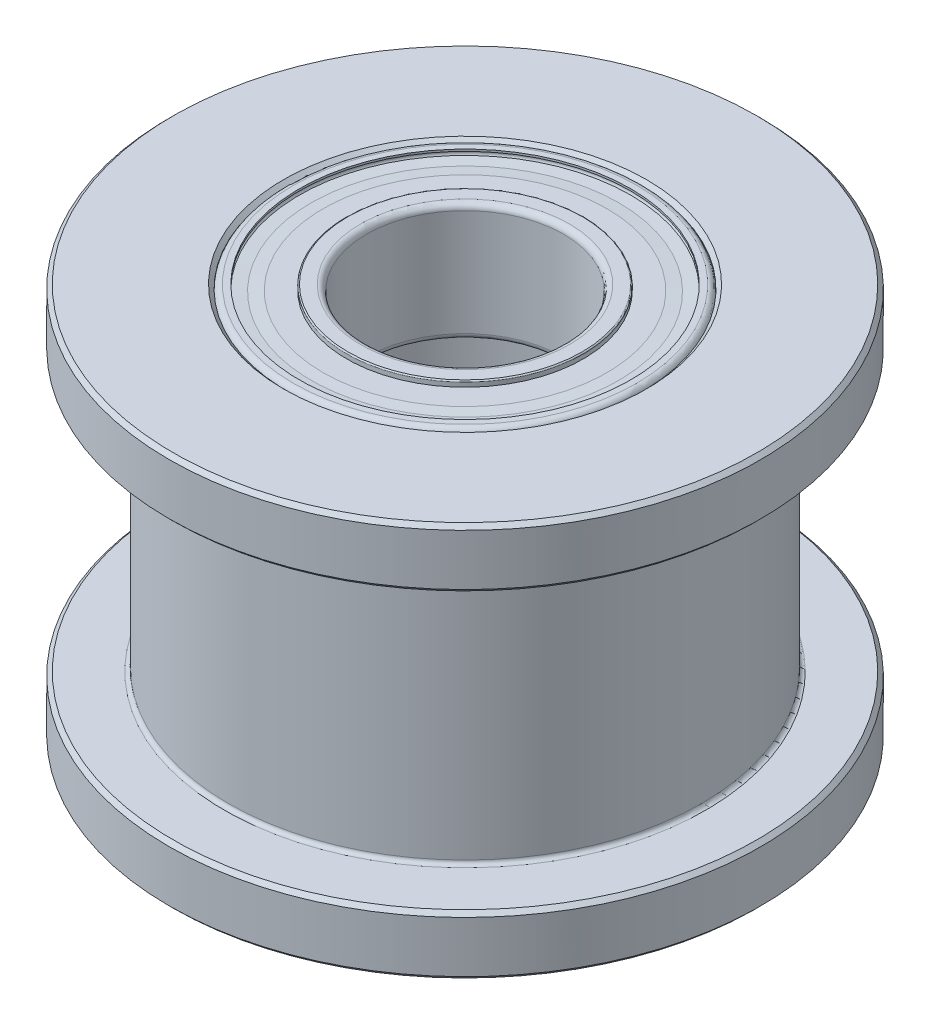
SolidWorks part; units mm, degrees
ref_plane "Přední rovina" through (0, 0, 0) normal (0, 0, 1) x (1, 0, 0)
ref_plane "Horní rovina" through (0, 0, 0) normal (0, 1, 0) x (1, 0, 0)
ref_plane "Pravá rovina" through (0, 0, 0) normal (1, 0, 0) x (0, 0, -1)
sketch "Skica1" plane through (0, 0, 0) normal (0, 0, 1) x (1, 0, 0)
  line L0 (4.5, 10) -> (7.5, 10)
  line L1 (7.5, 10) -> (7.5, 8.5)
  line L2 (7.5, 8.5) -> (6, 8.5)
  line L3 (6, 8.5) -> (6, 1.5)
  line L4 (6, 1.5) -> (7.5, 1.5)
  line L5 (7.5, 1.5) -> (7.5, 0)
  line L6 (7.5, 0) -> (4.5, 0)
  line L8 (4.5, 10) -> (4.5, 7)
  line L9 (4.5, 7) -> (3.5, 7)
  line L10 (3.5, 7) -> (3.5, 3)
  line L11 (3.5, 3) -> (4.5, 3)
  line L12 (4.5, 3) -> (4.5, 0)
  line L13 (0, 0) -> (0, -4.1646) construction
  dimension "D1" = 1.5
  dimension "D2" = 7
  dimension "D3" = 4.5
  dimension "D4" = 3.5
  dimension "D5" = 6
  dimension "D6" = 3
  dimension "D7" = 7.5
revolve "Rotovat1" add sketch "Skica1" angle 360 about L13
chamfer "Zkosení1" distance 0.1 angle 45 8 edges at (0, 3, 3.5) (0, 0, 4.5) (0, 7, 3.5) (0, 0, 7.5) (0, 1.5, 7.5) (0, 8.5, 7.5) (0, 10, 7.5) (0, 10, 4.5)
fillet "Zaoblit1" radius 0.1 4 edges at (0, 3, 4.5) (0, 1.5, 6) (0, 8.5, 6) (0, 7, 4.5)
sketch "Skica4" plane through (0, 0, 0) normal (0, 0, 1) x (1, 0, 0)
  line L0 (4.5, 9.85) -> (4.5, 7.15)
  line L1 (4.35, 7) -> (4.2, 7)
  line L2 (4.2, 7) -> (4.2, 7.05)
  line L3 (3.85, 7.2828) -> (4.2132, 7.229)
  line L4 (3.85, 7.2828) -> (3.85, 8.0528)
  line L5 (3.85, 8.9472) -> (3.85, 9.7172)
  line L6 (3.85, 9.7172) -> (4.2132, 9.771)
  line L7 (4.35, 10) -> (4.2, 10)
  line L8 (4.2, 10) -> (4.2, 9.95)
  line L9 (0, 0) -> (0, 18.4294) construction
  line L10 (4.4, 7) -> (-4.4, 7) construction
  arc A0 (4.35, 10) -> (4.5, 9.85) centre (4.35, 9.85) cw
  arc A1 (4.35, 7) -> (4.5, 7.15) centre (4.35, 7.15) ccw
  arc A2 (4.2, 9.95) -> (4.2132, 9.771) centre (4.2, 9.86) cw
  arc A3 (3.85, 8.9472) -> (3.85, 8.0528) centre (3.45, 8.5) cw
  arc A4 (4.2, 7.05) -> (4.2132, 7.229) centre (4.2, 7.14) ccw
  point P26 (4.5, 8.5)
  point P29 (4.275, 7)
  dimension "D3" = 0.09
  dimension "D6" = 0.15
  dimension "D7" = 0.6
  dimension "D1" = 4.5
  dimension "D2" = 3.85
  dimension "D4" = 0.05
  dimension "D5" = 0.15
  dimension "D8" = 0.77
  dimension "D9" = 3
  dimension "D10" = 1.05
revolve "Rotovat2" add sketch "Skica4" angle 360 about L9
sketch "Skica5" plane through (0, 0, 0) normal (0, 0, 1) x (1, 0, 0)
  line L0 (2.5, 9.85) -> (2.5, 7.15)
  line L1 (2.65, 10) -> (2.97, 10)
  line L2 (3, 9.97) -> (3, 9.86)
  line L3 (3, 9.86) -> (3.6, 9.86)
  line L4 (3.6, 9.86) -> (3.9, 9.84)
  line L5 (3.9, 9.84) -> (4.2, 9.86)
  line L6 (4.2, 9.86) -> (4.2, 9.81)
  line L7 (4.2, 9.81) -> (3.9, 9.77)
  line L8 (3.9, 9.77) -> (3.6, 9.77)
  line L9 (3.6, 9.77) -> (3, 9.81)
  line L10 (3, 9.81) -> (3, 8.8969)
  line L11 (2.65, 7) -> (2.97, 7)
  line L12 (0, 0) -> (0, 20.363) construction
  line L13 (3, 7.03) -> (3, 7.14)
  line L21 (3, 7.19) -> (3, 8.1031)
  line L22 (3, 7.14) -> (3.6, 7.14)
  line L23 (3.6, 7.14) -> (3.8962, 7.1917)
  line L24 (3.8962, 7.1917) -> (4.1924, 7.14)
  line L25 (4.1924, 7.14) -> (4.1924, 7.19)
  line L26 (4.1924, 7.19) -> (3.8975, 7.2581)
  line L27 (3.8975, 7.2581) -> (3.5975, 7.2581)
  line L28 (3.5975, 7.2581) -> (3, 7.19)
  line L29 (-4.2, 7) -> (4.2, 7) construction
  arc A0 (2.65, 7) -> (2.5, 7.15) centre (2.65, 7.15) cw
  arc A1 (2.65, 10) -> (2.5, 9.85) centre (2.65, 9.85) ccw
  arc A2 (3, 9.97) -> (2.97, 10) centre (2.97, 9.97) ccw
  arc A3 (3, 7.03) -> (2.97, 7) centre (2.97, 7.03) cw
  arc A4 (3, 8.8969) -> (3, 8.1031) centre (3.45, 8.5) ccw
  dimension "D3" = 0.15
  dimension "D4" = 0.11
  dimension "D5" = 0.03
  dimension "D7" = 0.6
  dimension "D1" = 2.5
  dimension "D2" = 3
  dimension "D6" = 0.6
  dimension "D8" = 0.95
  dimension "D9" = 3
  dimension "D10" = 1.2
  dimension "D11" = 0.3
  dimension "D12" = 0.05
  dimension "D13" = 0.9
  dimension "D14" = 0.6
  dimension "D15" = 0.09
  dimension "D16" = 0.05
  dimension "D17" = 0.05
revolve "Rotovat3" add sketch "Skica5" angle 360 about L12
sketch "Skica6" plane through (0, 0, 0) normal (0, 0, 1) x (1, 0, 0)
  line L0 (3.45, 9.1) -> (3.45, 7.9)
  line L4 (-4.2, 7) -> (4.2, 7) construction
  arc A0 (3.45, 9.1) -> (3.45, 7.9) centre (3.45, 8.5) cw
  dimension "D1" = 0.6
  dimension "D2" = 1.5
  dimension "D3" = 3.45
revolve "Rotovat4" add sketch "Skica6" angle 360 about L0
pattern_circular "Kruhové pole1" count 8 over 360 about axis through (0, 0, 0) along (0, 1, 0)
sketch "Skica7" plane through (0, 0, 0) normal (0, 0, 1) x (1, 0, 0)
  line L0 (4.5, 2.85) -> (4.5, 0.15)
  line L1 (4.35, 0) -> (4.2, 0)
  line L2 (4.2, 0) -> (4.2, 0.05)
  line L3 (3.85, 0.2828) -> (4.2132, 0.229)
  line L4 (3.85, 0.2828) -> (3.85, 1.0528)
  line L5 (3.85, 1.9472) -> (3.85, 2.7172)
  line L6 (3.85, 2.7172) -> (4.2132, 2.771)
  line L7 (4.35, 3) -> (4.2, 3)
  line L8 (4.2, 3) -> (4.2, 2.95)
  line L9 (0, 0) -> (0, 11.2374) construction
  arc A0 (4.35, 3) -> (4.5, 2.85) centre (4.35, 2.85) cw
  arc A1 (4.35, 0) -> (4.5, 0.15) centre (4.35, 0.15) ccw
  arc A2 (4.2, 2.95) -> (4.2132, 2.771) centre (4.2, 2.86) cw
  arc A3 (3.85, 1.9472) -> (3.85, 1.0528) centre (3.45, 1.5) cw
  arc A4 (4.2, 0.05) -> (4.2132, 0.229) centre (4.2, 0.14) ccw
  point P19 (4.5, 1.5)
  point P20 (4.275, 0)
  dimension "D1" = 0.09
  dimension "D4" = 0.15
  dimension "D5" = 0.6
  dimension "D2" = 0.05
  dimension "D3" = 0.15
  dimension "D6" = 0.77
  dimension "D7" = 3
  dimension "D8" = 1.05
  dimension "D9" = 4.5
  dimension "D10" = 3.85
revolve "Rotovat5" add sketch "Skica7" angle 360 about L9
sketch "Skica8" plane through (0, 0, 0) normal (0, 0, 1) x (1, 0, 0)
  line L0 (2.5, 2.85) -> (2.5, 0.15)
  line L1 (2.65, 3) -> (2.97, 3)
  line L2 (3, 2.97) -> (3, 2.86)
  line L3 (3, 2.86) -> (3.6, 2.86)
  line L4 (3.6, 2.86) -> (3.9, 2.84)
  line L5 (3.9, 2.84) -> (4.2, 2.86)
  line L6 (4.2, 2.86) -> (4.2, 2.81)
  line L7 (4.2, 2.81) -> (3.9, 2.77)
  line L8 (3.9, 2.77) -> (3.6, 2.77)
  line L9 (3.6, 2.77) -> (3, 2.81)
  line L10 (3, 2.81) -> (3, 1.8969)
  line L11 (2.65, 0) -> (2.97, 0)
  line L12 (3, 0.03) -> (3, 0.14)
  line L13 (3, 0.19) -> (3, 1.1031)
  line L14 (3, 0.14) -> (3.6, 0.14)
  line L15 (3.6, 0.14) -> (3.8962, 0.1917)
  line L16 (3.8962, 0.1917) -> (4.1924, 0.14)
  line L17 (4.1924, 0.14) -> (4.1924, 0.19)
  line L18 (4.1924, 0.19) -> (3.8975, 0.2581)
  line L19 (3.8975, 0.2581) -> (3.5975, 0.2581)
  line L20 (3.5975, 0.2581) -> (3, 0.19)
  line L21 (0, 0) -> (0, -2.9362) construction
  arc A0 (2.65, 0) -> (2.5, 0.15) centre (2.65, 0.15) cw
  arc A1 (2.65, 3) -> (2.5, 2.85) centre (2.65, 2.85) ccw
  arc A2 (3, 2.97) -> (2.97, 3) centre (2.97, 2.97) ccw
  arc A3 (3, 0.03) -> (2.97, 0) centre (2.97, 0.03) cw
  arc A4 (3, 1.8969) -> (3, 1.1031) centre (3.45, 1.5) ccw
  dimension "D1" = 0.15
  dimension "D2" = 0.03
  dimension "D5" = 0.6
  dimension "D3" = 0.11
  dimension "D4" = 0.6
  dimension "D6" = 0.95
  dimension "D7" = 3
  dimension "D8" = 1.2
  dimension "D9" = 0.3
  dimension "D10" = 0.05
  dimension "D11" = 0.9
  dimension "D12" = 0.6
  dimension "D13" = 0.09
  dimension "D14" = 0.05
  dimension "D15" = 0.05
  dimension "D16" = 2.5
  dimension "D17" = 3
revolve "Rotovat6" add sketch "Skica8" angle 360 about L21
sketch "Skica9" plane through (0, 0, 0) normal (0, 0, 1) x (1, 0, 0)
  line L0 (3.45, 2.1) -> (3.45, 0.9)
  line L1 (0, -2.351) -> (0, 5.6956) construction
  arc A0 (3.45, 2.1) -> (3.45, 0.9) centre (3.45, 1.5) cw
  dimension "D1" = 0.6
  dimension "D2" = 3.45
  dimension "D3" = 1.5
revolve "Rotovat7" add sketch "Skica9" angle 360 about L0
pattern_circular "Kruhové pole3" count 8 over 360 about axis through (0, 0, 0) along (0, 1, 0)
